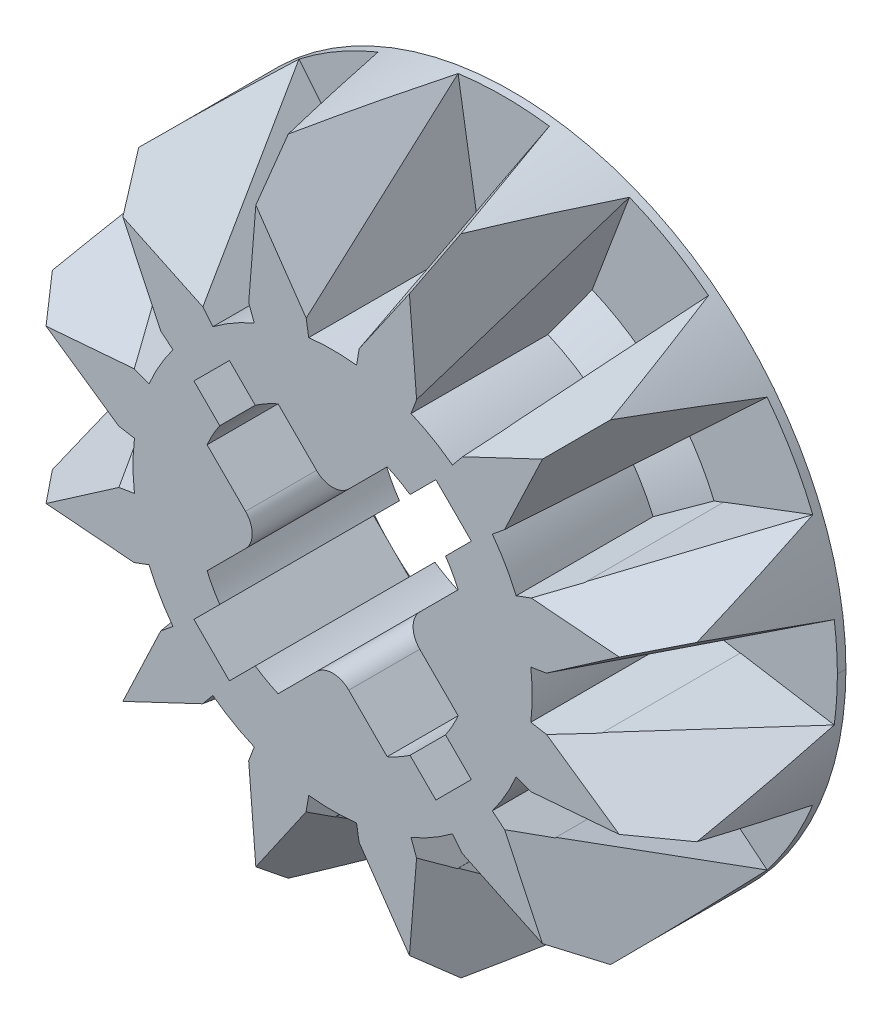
SolidWorks part; units mm, degrees
ref_plane "Front Plane" through (0, 0, 0) normal (0, 0, 1) x (1, 0, 0)
ref_plane "Top Plane" through (0, 0, 0) normal (0, 1, 0) x (1, 0, 0)
ref_plane "Right Plane" through (0, 0, 0) normal (1, 0, 0) x (0, 0, -1)
ref_plane "Plane1" through (0, 0, 0) normal (0.5, 0.866, 0) x (0.866, -0.5, 0)
imported_body "Technic, Gear 12 Tooth Bevel5.CATPart"
sketch "Sketch1" plane through (0, 0, -4.6) normal (0, 0, -1) x (-1, 0, 0)
  circle A0 centre (0, 0) radius 4.5809
extrude "Cut-Extrude1" cut sketch "Sketch1" against normal up to surface (0.7 mm away)
sketch "Sketch2" plane through (0, 0, 0) normal (0, 0, 1) x (1, 0, 0)
  circle A0 centre (0, 0) radius 5.5
  dimension "D1" = 11
extrude "Cut-Extrude4" cut sketch "Sketch2" against normal blind 0.4 contours A0
sketch "Sketch3" plane through (0, 0, -3.9) normal (0, 0, -1) x (-1, 0, 0)
  circle A0 centre (0, 0) radius 7.5995
extrude "Cut-Extrude5" cut sketch "Sketch3" against normal blind 0.35
sketch "Sketch4" plane through (0, 0, -3.55) normal (0, 0, -1) x (-1, 0, 0)
  circle A0 centre (0, 0) radius 3.5
  circle A1 centre (0, 0) radius 4.15
extrude "Boss-Extrude1" add sketch "Sketch4" along normal blind 0.35
sketch "Sketch5" plane through (0, 0, -0.4) normal (0, 0, 1) x (1, 0, 0)
  circle A0 centre (0, 0) radius 3.1848
extrude "Boss-Extrude2" add sketch "Sketch5" against normal up to surface (3.15 mm away)
sketch "Sketch6" plane through (0, 0, -0.4) normal (0, 0, 1) x (1, 0, 0)
  line L0 (0.9566, 2.2011) -> (0.2828, 1.5274)
  line L1 (2.2011, 0.9566) -> (1.5274, 0.2828)
  line L2 (2.2011, -0.9566) -> (1.5274, -0.2828)
  line L3 (-2.2011, 0.9566) -> (-1.5274, 0.2828)
  line L4 (-0.2828, 1.5274) -> (-0.9566, 2.2011)
  line L5 (-1.5274, -0.2828) -> (-2.2011, -0.9566)
  line L6 (0.2828, -1.5274) -> (0.9566, -2.2011)
  line L7 (-0.2828, -1.5274) -> (-0.9566, -2.2011)
  line L8 (1.3572, 1.9794) -> (1.8102, 2.4324)
  line L9 (2.4324, 1.8102) -> (1.9794, 1.3572)
  line L10 (1.8102, 2.4324) -> (2.4324, 1.8102)
  line L12 (1.9794, -1.3572) -> (2.4324, -1.8102)
  line L13 (2.4324, -1.8102) -> (1.8102, -2.4324)
  line L14 (1.8102, -2.4324) -> (1.3572, -1.9794)
  line L15 (-1.3572, -1.9794) -> (-1.8102, -2.4324)
  line L16 (-1.8102, -2.4324) -> (-2.4324, -1.8102)
  line L17 (-2.4324, -1.8102) -> (-1.9794, -1.3572)
  line L18 (-1.9794, 1.3572) -> (-2.4324, 1.8102)
  line L19 (-2.4324, 1.8102) -> (-1.8102, 2.4324)
  line L20 (-1.8102, 2.4324) -> (-1.3572, 1.9794)
  arc A0 (2.2011, 0.9566) -> (1.9794, 1.3572) centre (0, 0) ccw
  arc A1 (0.9566, -2.2011) -> (1.3572, -1.9794) centre (0, 0) ccw
  arc A2 (-2.2011, -0.9566) -> (-1.9794, -1.3572) centre (0, 0) ccw
  arc A3 (-0.9566, 2.2011) -> (-1.3572, 1.9794) centre (0, 0) ccw
  arc A4 (1.3572, 1.9794) -> (0.9566, 2.2011) centre (0, 0) ccw
  arc A5 (-1.5274, -0.2828) -> (-1.5274, 0.2828) centre (-1.8102, 0) ccw
  arc A6 (0.2828, -1.5274) -> (-0.2828, -1.5274) centre (0, -1.8102) ccw
  arc A7 (1.5274, -0.2828) -> (1.5274, 0.2828) centre (1.8102, 0) cw
  arc A8 (-0.2828, 1.5274) -> (0.2828, 1.5274) centre (0, 1.8102) ccw
  arc A9 (-1.9794, 1.3572) -> (-2.2011, 0.9566) centre (0, 0) ccw
  arc A10 (1.9794, -1.3572) -> (2.2011, -0.9566) centre (0, 0) ccw
  arc A11 (-1.3572, -1.9794) -> (-0.9566, -2.2011) centre (0, 0) ccw
  point P18 (0, -1.2445)
  point P42 (0, 0)
  dimension "D1" = 0.88
  dimension "D5" = 4.8
  dimension "D6" = 0.4
  dimension "D2" = 1.76
  dimension "D3" = 0.88
  dimension "D4" = 1.76
  dimension "D7" = 0.44
  dimension "D8" = 0.44
  dimension "D9" = 3
  dimension "D10" = 4
extrude "Cut-Extrude6" cut sketch "Sketch6" against normal through all
